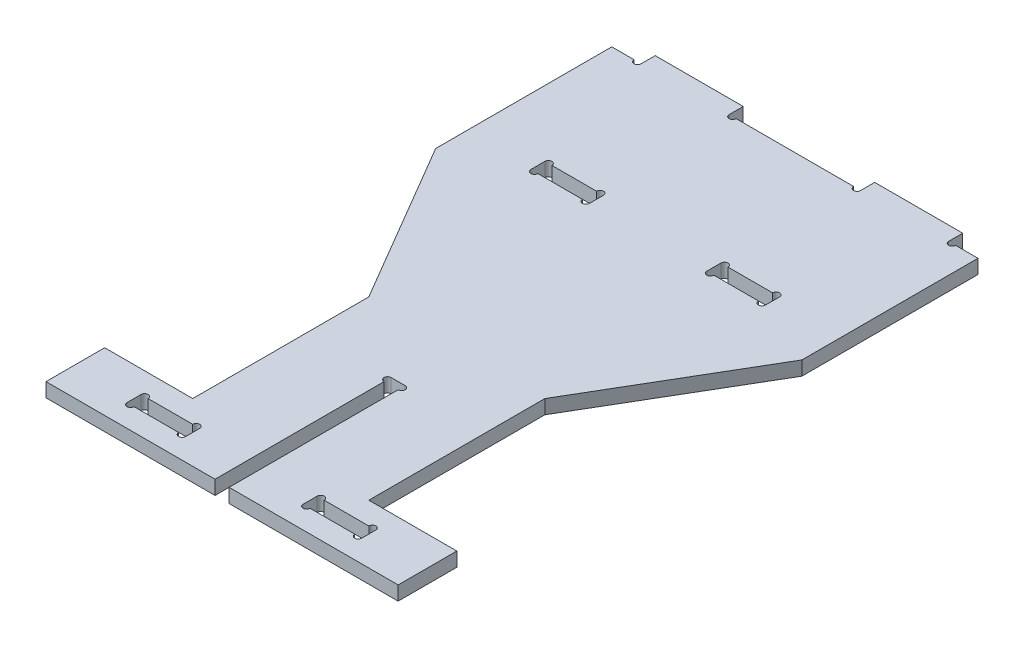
SolidWorks part; units mm, degrees
ref_plane "Front" through (0, 0, 0) normal (0, 0, 1) x (1, 0, 0)
ref_plane "Top" through (0, 0, 0) normal (0, 1, 0) x (1, 0, 0)
ref_plane "Right" through (0, 0, 0) normal (1, 0, 0) x (0, 0, -1)
sketch "Sketch1" plane through (0, 0, 0) normal (0, 1, 0) x (1, 0, 0)
  line L0 (0, 617.5571) -> (0, -173.9673) construction
  line L1 (-150, 0) -> (-6, 0)
  line L2 (150, 0) -> (150, 50)
  line L3 (150, 50) -> (75, 50)
  line L4 (75, 50) -> (75, 200)
  line L5 (75, 200) -> (156, 338)
  line L6 (156, 338) -> (156, 488)
  line L7 (156, 488) -> (137, 488)
  line L8 (131, 488) -> (131, 500)
  line L9 (131, 500) -> (56, 500)
  line L10 (56, 500) -> (56, 488)
  line L11 (50, 488) -> (0, 488)
  line L13 (6, 150) -> (-6, 150)
  line L16 (-50, 488) -> (0, 488)
  line L17 (-56, 500) -> (-56, 488)
  line L18 (-131, 500) -> (-56, 500)
  line L19 (-131, 488) -> (-131, 500)
  line L20 (-156, 488) -> (-137, 488)
  line L21 (-156, 338) -> (-156, 488)
  line L22 (-75, 200) -> (-156, 338)
  line L23 (-75, 50) -> (-75, 200)
  line L24 (-150, 50) -> (-75, 50)
  line L25 (-150, 0) -> (-150, 50)
  line L26 (56, 19) -> (94, 19)
  line L27 (56, 31) -> (94, 31)
  line L28 (100, 31) -> (100, 19)
  line L29 (50, 31) -> (50, 19)
  line L30 (75, 45.4288) -> (75, 4.4864) construction
  line L32 (56, 375) -> (94, 375)
  line L33 (50, 375) -> (50, 363)
  line L34 (56, 363) -> (94, 363)
  line L35 (100, 375) -> (100, 363)
  line L43 (50, 19) -> (50, 439.609) construction
  line L44 (-6, 144) -> (-6, 0)
  line L45 (6, 144) -> (6, 0)
  line L46 (6, 0) -> (150, 0)
  line L47 (50, 19) -> (100, 19) construction
  line L48 (50, 31) -> (100, 31) construction
  line L49 (-100, 31) -> (-100, 19)
  line L50 (-50, 31) -> (-50, 19)
  line L51 (-56, 19) -> (-94, 19)
  line L52 (-56, 31) -> (-94, 31)
  line L53 (-56, 375) -> (-94, 375)
  line L54 (-100, 375) -> (-100, 363)
  line L55 (-56, 363) -> (-94, 363)
  line L56 (-50, 375) -> (-50, 363)
  arc A0 (6, 144) -> (6, 150) centre (6, 147) ccw
  arc A1 (-6, 150) -> (-6, 144) centre (-6, 147) ccw
  arc A2 (100, 31) -> (94, 31) centre (97, 31) ccw
  arc A3 (94, 19) -> (100, 19) centre (97, 19) ccw
  arc A4 (56, 31) -> (50, 31) centre (53, 31) ccw
  arc A5 (50, 19) -> (56, 19) centre (53, 19) ccw
  arc A6 (-94, 19) -> (-100, 19) centre (-97, 19) cw
  arc A7 (-100, 31) -> (-94, 31) centre (-97, 31) cw
  arc A8 (-56, 31) -> (-50, 31) centre (-53, 31) cw
  arc A9 (-50, 19) -> (-56, 19) centre (-53, 19) cw
  arc A10 (100, 375) -> (94, 375) centre (97, 375) ccw
  arc A11 (94, 363) -> (100, 363) centre (97, 363) ccw
  arc A12 (50, 363) -> (56, 363) centre (53, 363) ccw
  arc A13 (56, 375) -> (50, 375) centre (53, 375) ccw
  arc A14 (-100, 375) -> (-94, 375) centre (-97, 375) cw
  arc A15 (-94, 363) -> (-100, 363) centre (-97, 363) cw
  arc A16 (-50, 363) -> (-56, 363) centre (-53, 363) cw
  arc A17 (-56, 375) -> (-50, 375) centre (-53, 375) cw
  arc A18 (131, 488) -> (137, 488) centre (134, 488) ccw
  arc A19 (50, 488) -> (56, 488) centre (53, 488) ccw
  arc A20 (-56, 488) -> (-50, 488) centre (-53, 488) ccw
  arc A21 (-137, 488) -> (-131, 488) centre (-134, 488) ccw
  point P23 (0, 150)
  point P34 (0, 0)
extrude "Boss-Extrude1" add sketch "Sketch1" along normal blind 12
equation "\"WoodThickness\"= 12mm"
equation "\"Table Hight\"= 500mm"
equation "\"SlotWidth1\"= 75mm"
equation "\"SlotWidth2\"= 50mm"
equation "\"CoreWidth\"= 150"
equation "\"D1@Sketch1\"=\"Table Hight\""
equation "\"D4@Sketch1\"=\"SlotWidth2\""
equation "\"D6@Sketch1\"=\"SlotWidth1\""
equation "\"D15@Sketch1\"=\"SlotWidth2\""
equation "\"D5@Sketch1\"=\"CoreWidth\""
equation "\"D16@Sketch1\"=\"SlotWidth1\""
equation "\"D14@Sketch1\"=\"WoodThickness\""
equation "\"D9@Sketch1\"=\"CoreWidth\""
equation "\"D17@Sketch1\"=\"SlotWidth2\""
equation "\"D11@Sketch1\"=\"CoreWidth\""
equation "\"D8@Sketch1\"=\"SlotWidth1\""
equation "\"D3@Sketch1\"=\"WoodThickness\""
equation "\"D18@Sketch1\"=\"WoodThickness\""
equation "\"D2@Sketch1\"=\"WoodThickness\"/2"
equation "\"D20@Sketch1\"=\"SlotWidth2\""
equation "\"D10@Sketch1\"=\"CoreWidth\""
equation "\"D7@Sketch1\"=\"SlotWidth2\"+(\"WoodThickness\"/2)"
equation "\"D12@Sketch1\"=\"CoreWidth\"+(\"WoodThickness\"/2)"
